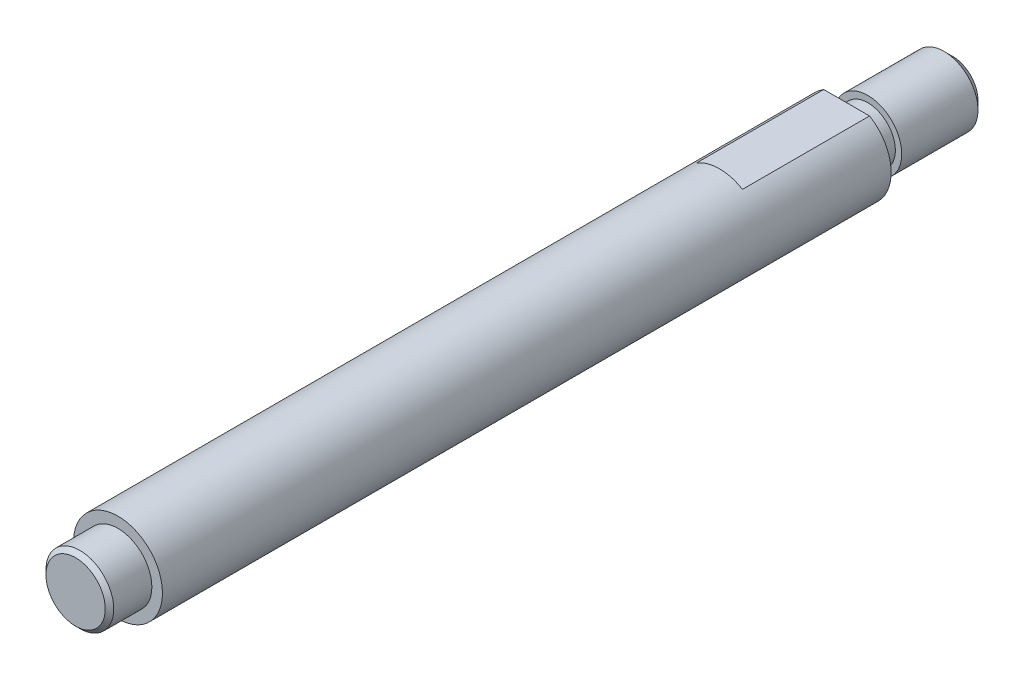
SolidWorks part; units mm, degrees
ref_plane "Plan de face" through (0, 0, 0) normal (0, 0, 1) x (1, 0, 0)
ref_plane "Plan de dessus" through (0, 0, 0) normal (0, 1, 0) x (1, 0, 0)
ref_plane "Plan de droite" through (0, 0, 0) normal (1, 0, 0) x (0, 0, -1)
sketch "Esquisse1" plane through (0, 0, 0) normal (0, 0, 1) x (1, 0, 0)
  circle A0 centre (0, 0) radius 5.25
  dimension "D1" = 10.5
extrude "Extrusion1" add sketch "Esquisse1" along normal blind 86
sketch "Esquisse2" plane through (0, 0, 86) normal (0, 0, 1) x (1, 0, 0)
  circle A0 centre (0, 0) radius 4
  dimension "D1" = 8
extrude "Extrusion2" add sketch "Esquisse2" along normal blind 5
sketch "Esquisse3" plane through (0, 0, 0) normal (0, 0, -1) x (-1, 0, 0)
  circle A0 centre (0, 0) radius 3.25
  dimension "D1" = 6.5
extrude "Extrusion3" add sketch "Esquisse3" along normal blind 2.5
sketch "Esquisse4" plane through (0, 0, -2.5) normal (0, 0, -1) x (-1, 0, 0)
  circle A0 centre (0, 0) radius 4
  dimension "D1" = 8
extrude "Extrusion4" add sketch "Esquisse4" along normal blind 10
chamfer "Chanfrein1" distance 1 angle 45 1 edges at (-4, 0, -12.5)
chamfer "Chanfrein2" distance 0.5 angle 45 1 edges at (4, 0, 91)
ref_plane "Plan1" through (0, 4.5, 0) normal (0, 1, 0) x (-1, 0, 0)
sketch "Esquisse5" plane through (0, 4.5, 0) normal (0, 1, 0) x (-1, 0, 0)
  line L0 (0, 0) -> (0, 22.5952) construction
  line L1 (-3.25, 0) -> (3.25, 0) construction
  line L2 (23.8184, 0) -> (-33.5101, 0)
  line L3 (23.8184, 0) -> (23.8184, 15)
  line L4 (23.8184, 15) -> (-33.5101, 15)
  line L5 (-33.5101, 0) -> (-33.5101, 15)
  line L6 (-5.25, 0) -> (5.25, 0) construction
  dimension "D1" = 15
extrude "Enlèv. mat.-Extru.1" cut sketch "Esquisse5" along normal through all
ref_plane "Plan2" through (0, -4.5, 0) normal (0, 1, 0) x (-1, 0, 0)
sketch "Esquisse7" plane through (0, -4.5, 0) normal (0, 1, 0) x (-1, 0, 0)
  line L1 (-2.7042, 15) -> (2.7042, 15)
  line L2 (-2.7042, 15) -> (-2.7042, 0)
  line L3 (-2.7042, 0) -> (2.7042, 0)
  line L4 (2.7042, 15) -> (2.7042, 0)
extrude "Enlèv. mat.-Extru.2" cut sketch "Esquisse7" against normal through all
